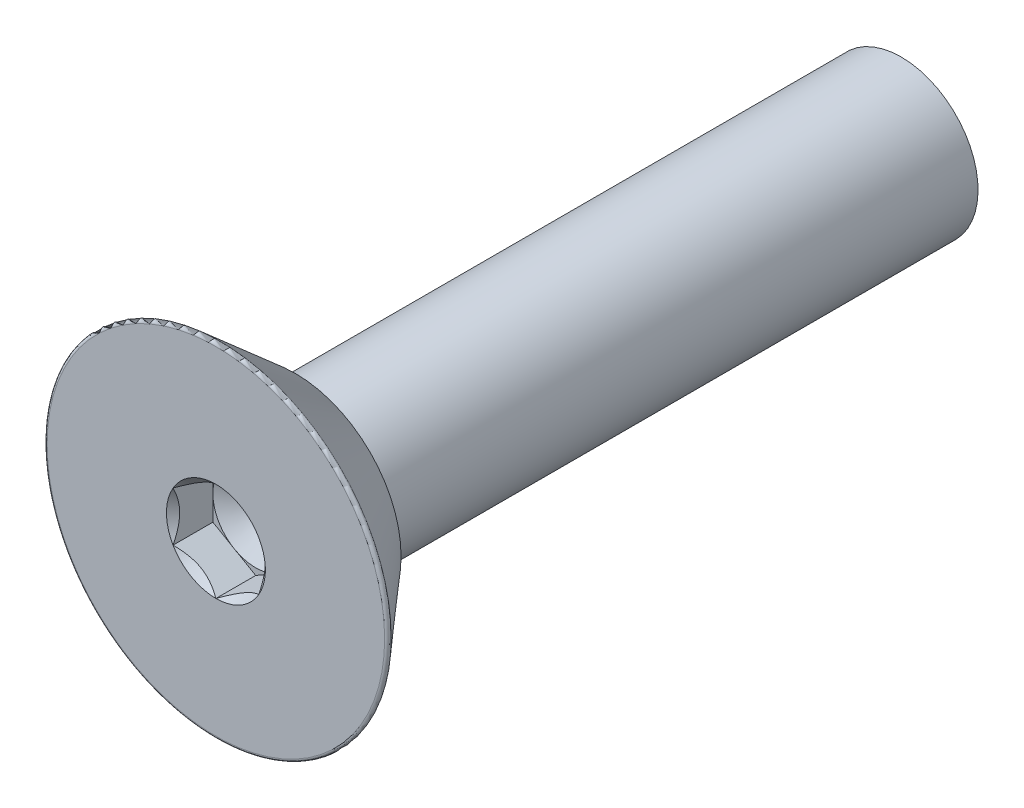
SolidWorks part; units mm, degrees
ref_plane "Front" through (0, 0, 0) normal (0, 0, 1) x (1, 0, 0)
ref_plane "Top" through (0, 0, 0) normal (0, 1, 0) x (1, 0, 0)
ref_plane "Right" through (0, 0, 0) normal (1, 0, 0) x (0, 0, -1)
sketch "Sketch1" plane through (0, 0, 0) normal (1, 0, 0) x (0, 0, -1)
  line L0 (0, 0) -> (-1.4757, 0) construction
  line L1 (0, 0) -> (11.2243, 0)
  line L2 (0, 0) -> (0, 1.4224)
  line L3 (0, 1.4224) -> (11.2243, 1.4224)
  line L4 (11.2243, 0) -> (11.2243, 1.4224)
  line L5 (0, -1.4224) -> (11.2243, -1.4224) construction
  dimension "D1" = 11.2243
  dimension "Thread Dia" = 2.8448
  dimension "Length" = 12.7
  dimension "Head Height" = 1.4757
revolve "Revolve1" add sketch "Sketch1" angle 360 about L0
ref_plane "Plane1" through (0, 0, 1.4757) normal (0, 0, 1) x (1, 0, 0)
sketch "Sketch4" plane through (0, 0, 0) normal (0, 0, 1) x (1, 0, 0)
  circle A0 centre (0, 0) radius 3.2385
  dimension "Head Dia" = 6.477
extrude "Extrude1" add sketch "Sketch4" along normal up to surface (1.4757 mm away)
sketch "Sketch9" plane through (0, 0, 0) normal (1, 0, 0) x (0, 0, -1)
  line L0 (-1.4757, 3.2385) -> (0, 1.9557)
  line L1 (0, 1.9557) -> (0, 3.2385)
  line L2 (0, 3.2385) -> (-1.4757, 3.2385)
  line L3 (0, 0) -> (-1.4757, 0) construction
  line L6 (-1.4757, -3.2385) -> (0, -1.9557) construction
  line L7 (0, -3.2385) -> (0, 3.2385) construction
  line L8 (-1.4757, 3.2385) -> (-1.4757, -3.2385) construction
  line L9 (0, 3.2385) -> (-1.4757, 3.2385) construction
  dimension "D1" = 82
revolve "Cut-Revolve3" cut sketch "Sketch9" angle 360 about L3
fillet "Fillet1" radius 0.0508 1 edges at (0, 3.2385, 1.4757)
sketch "Sketch6" plane through (0, 0, 1.4757) normal (0, 0, 1) x (1, 0, 0)
  line L1 (0, -0.9165) -> (0.7937, -0.4583)
  line L2 (0.7937, -0.4583) -> (0.7937, 0.4583)
  line L3 (0.7937, 0.4583) -> (0, 0.9165)
  line L4 (0, 0.9165) -> (-0.7938, 0.4583)
  line L5 (-0.7938, 0.4583) -> (-0.7938, -0.4583)
  line L6 (-0.7938, -0.4583) -> (0, -0.9165)
  circle A0 centre (0, 0) radius 0.7938 construction
  dimension "Hex" = 1.5875
extrude "Cut-Extrude1" cut sketch "Sketch6" against normal blind 0.7379
sketch "Sketch7" plane through (0, 0, 1.4757) normal (0, 0, 1) x (1, 0, 0)
  circle A0 centre (0, 0) radius 0.9165
extrude "Cut-Extrude4" cut sketch "Sketch7" against normal blind 0.7379 draft 45
sketch "Sketch8" plane through (0, 0, 0.7379) normal (0, 0, 1) x (1, 0, 0)
  circle A0 centre (0, 0) radius 0.7938 construction
  circle A1 centre (0, 0) radius 0.7938
extrude "Cut-Extrude5" cut sketch "Sketch8" against normal blind 0.246 draft 60
